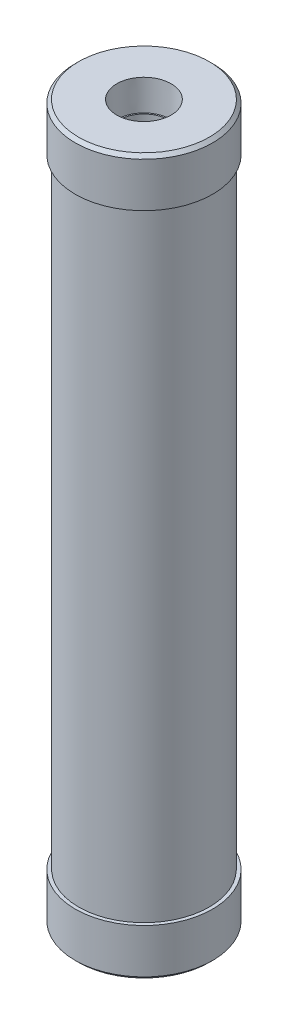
SolidWorks part; units mm, degrees
ref_plane "Front Plane" through (0, 0, 0) normal (0, 0, 1) x (1, 0, 0)
ref_plane "Top Plane" through (0, 0, 0) normal (0, 1, 0) x (1, 0, 0)
ref_plane "Right Plane" through (0, 0, 0) normal (1, 0, 0) x (0, 0, -1)
sketch "Sketch1" plane through (0, 0, 0) normal (0, 1, 0) x (1, 0, 0)
  circle A0 centre (0, 0) radius 30.1625
  circle A1 centre (0, 0) radius 25.9969
  dimension "D1" = 60.325
  dimension "D2" = 4.1656
extrude "Boss-Extrude1" add sketch "Sketch1" along normal blind 330.2
ref_plane "Plane1" through (0, 330.2, 0) normal (0, 1, 0) x (1, 0, 0)
sketch "Sketch2" plane through (0, 330.2, 0) normal (0, 1, 0) x (1, 0, 0)
  circle A0 centre (0, 0) radius 31.75
  dimension "D1" = 63.5
extrude "Boss-Extrude2" add sketch "Sketch2" against normal blind 22.098
hole_wizard "3/4 NPT Tapped Hole1" positions "Sketch4" profile "Sketch3" size "3/4" standard "ANSI Inch"
sketch "Sketch4" plane through (0, 330.2, 0) normal (0, 1, 0) x (1, 0, 0)
  point P0 (0, 0)
sketch "Sketch3" plane through (0, 330.2, 0) normal (1, 0, 0) x (0, 0, 1)
  line L0 (0, 0) -> (0, 30.0276)
  line L1 (11.5062, 23.114) -> (0, 30.0276)
  line L2 (-11.5062, 23.114) -> (0, 30.0276) construction
  line L3 (11.5062, 23.114) -> (11.5062, 13.97)
  line L4 (11.5062, 13.97) -> (12.1379, 13.97)
  line L5 (12.1379, 13.97) -> (12.5561, 0)
  line L6 (-12.1379, 13.97) -> (-12.5561, 0) construction
  line L7 (12.5561, 0) -> (0, 0)
  line L8 (0, -6.35) -> (0, 107.95) construction
  line L11 (-11.5062, 13.97) -> (-12.1379, 13.97) construction
  dimension "Tap Drill Dia." = 23.0124
  dimension "Tap Drill Depth" = 23.114
  dimension "Thread Dia." = 25.1123
  dimension "Thread Angle" = 3.43
  dimension "Thread Depth" = 13.97
  dimension "Drill Angle" = 118
sketch "Sketch5" plane through (0, 0, 0) normal (0, 1, 0) x (1, 0, 0)
  circle A0 centre (0, 0) radius 31.75
  dimension "D1" = 63.5
extrude "Boss-Extrude3" add sketch "Sketch5" along normal blind 22.098
hole_wizard "3/4 NPT Tapped Hole2" positions "Sketch7" profile "Sketch6" size "3/4" standard "ANSI Inch"
sketch "Sketch7" plane through (0, 0, 0) normal (0, 1, 0) x (1, 0, 0)
  point P0 (0, 0)
sketch "Sketch6" plane through (0, 0, 0) normal (1, 0, 0) x (0, 0, -1)
  line L0 (0, 0) -> (0, 30.0276)
  line L1 (11.5062, 23.114) -> (0, 30.0276)
  line L2 (-11.5062, 23.114) -> (0, 30.0276) construction
  line L3 (11.5062, 23.114) -> (11.5062, 13.97)
  line L4 (11.5062, 13.97) -> (12.1379, 13.97)
  line L5 (12.1379, 13.97) -> (12.5561, 0)
  line L6 (-12.1379, 13.97) -> (-12.5561, 0) construction
  line L7 (12.5561, 0) -> (0, 0)
  line L8 (0, -6.35) -> (0, 107.95) construction
  line L11 (-11.5062, 13.97) -> (-12.1379, 13.97) construction
  dimension "Tap Drill Dia." = 23.0124
  dimension "Tap Drill Depth" = 23.114
  dimension "Thread Dia." = 25.1123
  dimension "Thread Angle" = 3.43
  dimension "Thread Depth" = 13.97
  dimension "Drill Angle" = 118
chamfer "Chamfer1" distance 1.524 angle 45 2 edges at (0, 0, 31.75) (0, 330.2, 31.75)
